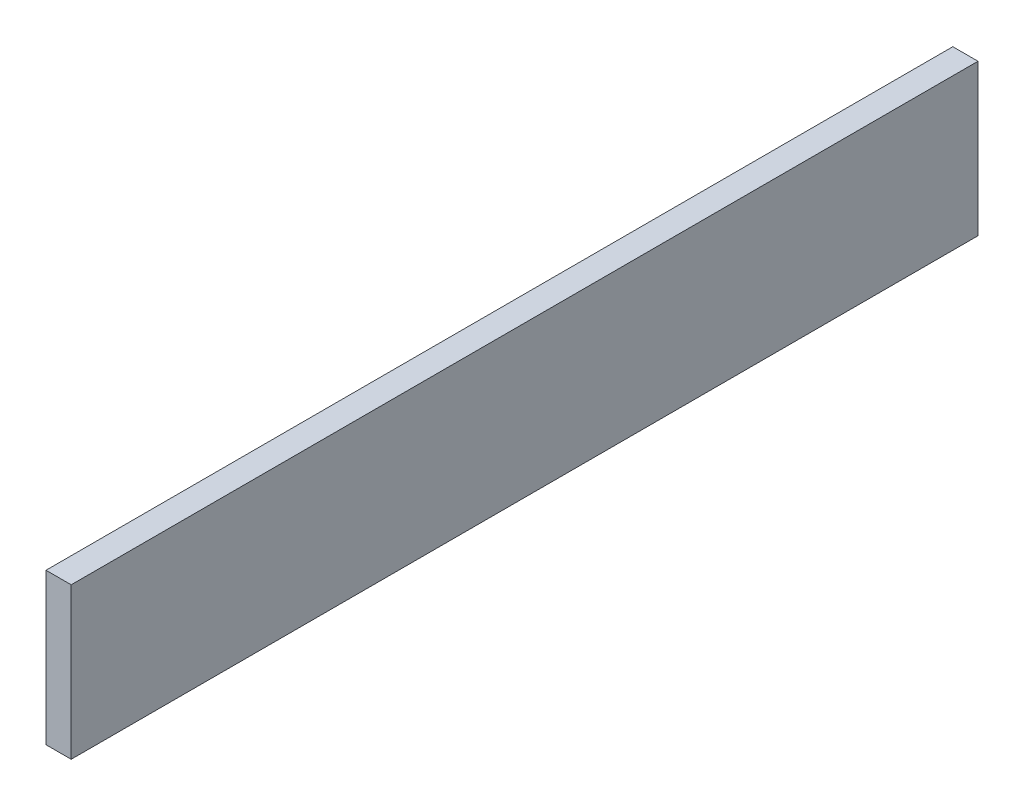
SolidWorks part; units mm, degrees
ref_plane "Front Plane" through (0, 0, 0) normal (0, 0, 1) x (1, 0, 0)
ref_plane "Top Plane" through (0, 0, 0) normal (0, 1, 0) x (1, 0, 0)
ref_plane "Right Plane" through (0, 0, 0) normal (1, 0, 0) x (0, 0, -1)
sketch "Sketch1" plane through (0, 0, 0) normal (0, 0, 1) x (1, 0, 0)
  line L0 (0, 0) -> (0, -19.05)
  line L1 (0, 0) -> (3.175, 0)
  line L3 (3.175, 0) -> (3.175, -19.05)
  line L5 (3.175, -19.05) -> (0, -19.05)
  dimension "D2" = 19.05
  dimension "D3" = 0
  dimension "D5" = 3.175
extrude "Boss-Extrude1" add sketch "Sketch1" along normal mid plane 114.3
